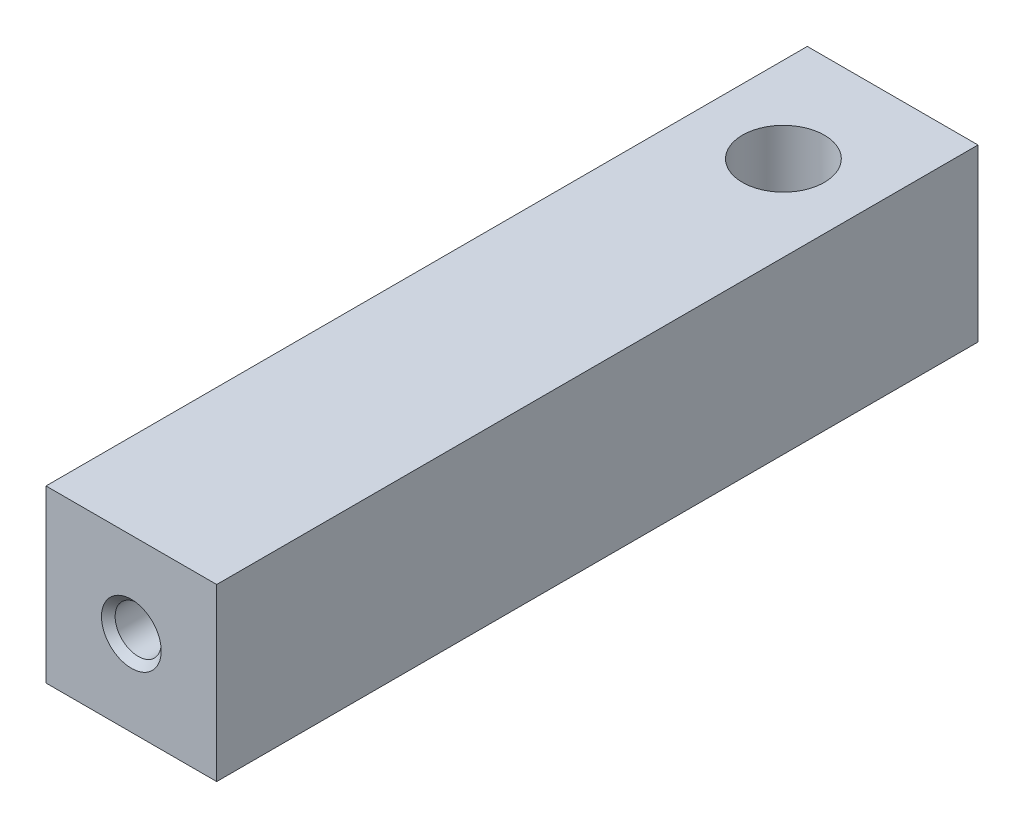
SolidWorks part; units mm, degrees
ref_plane "Plan1" through (0, 0, 0) normal (0, 0, 1) x (1, 0, 0)
ref_plane "Plan2" through (0, 0, 0) normal (0, 1, 0) x (1, 0, 0)
ref_plane "Plan3" through (0, 0, 0) normal (1, 0, 0) x (0, 0, -1)
sketch "Esquisse1" plane through (0, 0, 0) normal (0, 0, 1) x (1, 0, 0)
  line L0 (-12.5, -12.5) -> (12.5, -12.5)
  line L1 (12.5, -12.5) -> (12.5, 12.5)
  line L2 (12.5, 12.5) -> (-12.5, 12.5)
  line L3 (-12.5, 12.5) -> (-12.5, -12.5)
  line L4 (-12.5, 12.5) -> (12.5, -12.5) construction
  dimension "D1" = 25
  dimension "D2" = 25
extrude "Base-Extrusion" add sketch "Esquisse1" along normal blind 111.5
hole_wizard "Diamètre du perçage Ø6.7 (6.75)1" positions "Esquisse3" profile "Esquisse2" hole size "Ø6.7" standard "ISO"
sketch "Esquisse3" plane through (0, 0, 111.5) normal (0, 0, 1) x (1, 0, 0)
  line L1 (-12.5, -12.5) -> (12.5, -12.5) construction
  line L2 (0, -12.5) -> (0, 18.7472) construction
  point P0 (0, 0)
  dimension "D2" = 12.5
sketch "Esquisse2" plane through (0, 0, 111.5) normal (1, 0, 0) x (0, -1, 0)
  line L0 (0, 0) -> (0, 23.7779)
  line L1 (0, 23.7779) -> (3.375, 21.75)
  line L2 (3.375, 21.75) -> (3.375, 0)
  line L5 (3.375, 0) -> (0, 0)
  line L10 (0, 23.7779) -> (-3.375, 21.75) construction
  line L11 (0, -6.35) -> (0, 107.95) construction
  dimension "Diamètre du perçage" = 6.75
  dimension "Profondeur du perçage" = 21.75
  dimension "Angle de pointe" = 118
sketch "Esquisse4" plane through (0, 12.5, 0) normal (0, 1, 0) x (-1, 0, 0)
  line L0 (0, 89.75) -> (0, 111.5) construction
  line L1 (-12.5, 111.5) -> (12.5, 111.5) construction
  circle A0 centre (0, 16) radius 6
  dimension "D1" = 12
  dimension "D2" = 95.5
extrude "Enlèv. mat.-Extru.1" cut sketch "Esquisse4" against normal up to next
chamfer "Chanfrein1" distance 1 angle 45 1 edges at (3.375, 0, 111.5)
thread "Filetage1" pitch 1.25 start angle 0, offset 5, length 23, pitch 1.25, diameter 6.75
ref_plane "Plan4" through (-3.375, 0, 115.5) normal (0, -1, 0) x (-1, 0, 0)
sketch "Profil de filetage1" plane through (-3.375, 0, 115.5) normal (0, -1, 0) x (-1, 0, 0)
  line L0 (0, 0) -> (0, 1.25) construction
  line L1 (0, 0) -> (0.6766, 0.3906)
  line L2 (0.6766, 0.3906) -> (0.6766, 0.5469)
  line L3 (0.6766, 0.5469) -> (0, 0.9375)
  line L4 (0.6766, 0.4687) -> (0, 0.4687) construction
  line L11 (0, 0) -> (0, 0.9375)
  point P2 (0, 0)
  dimension "Pitch" = 1.25
  dimension "Profile_Angle" = 60
  dimension "Profile_Land" = 0.1562
  dimension "Profile_Height" = 0.6766
